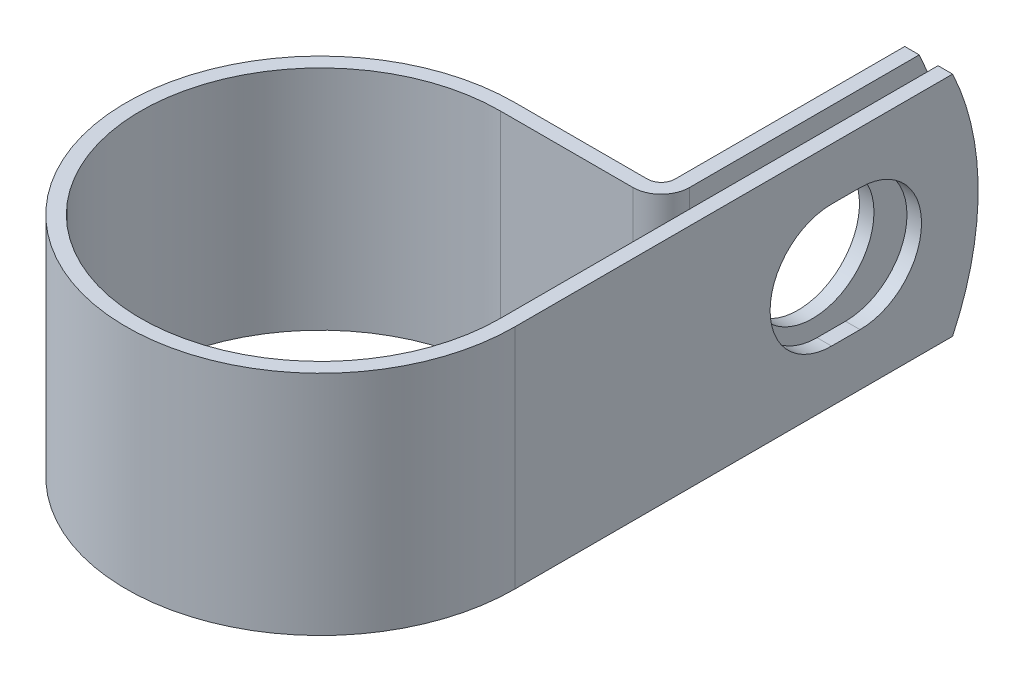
SolidWorks part; units mm, degrees
ref_plane "Front Plane" through (0, 0, 0) normal (0, 0, 1) x (1, 0, 0)
ref_plane "Top Plane" through (0, 0, 0) normal (0, 1, 0) x (1, 0, 0)
ref_plane "Right Plane" through (0, 0, 0) normal (1, 0, 0) x (0, 0, -1)
sketch "Sketch1" plane through (0, 0, 0) normal (0, 1, 0) x (1, 0, 0)
  line L0 (0, 15.0749) -> (11.1227, 15.0749)
  line L1 (15.0749, 0) -> (15.0749, 15.0749)
  line L2 (13.5001, 38.862) -> (13.5001, 17.4523)
  line L5 (15.0749, 15.0749) -> (15.0749, 38.862)
  arc A0 (0, 15.0749) -> (15.0749, 0) centre (0, 0) ccw
  arc A3 (11.1227, 15.0749) -> (13.5001, 17.4523) centre (11.1227, 17.4523) ccw
extrude "Extrude-Thin1" add sketch "Sketch1" along normal mid plane 19.05 thin
sketch "Sketch2" plane through (12.2809, 0, 0) normal (-1, 0, 0) x (0, 0, 1)
  line L0 (-38.862, 9.525) -> (-38.862, -9.525) construction
  line L7 (0, 9.525) -> (0, -9.525) construction
  circle A0 centre (-27.7622, 0) radius 5.1562
  point P2 (-38.862, 0)
extrude "Cut-Extrude1" cut sketch "Sketch2" against normal up to surface (1.2192 mm away)
sketch "Sketch3" plane through (16.2941, 0, 0) normal (1, 0, 0) x (0, 0, -1)
  line L0 (26.5684, 0) -> (28.956, 0) construction
  line L1 (26.5684, 5.1562) -> (28.956, 5.1562)
  line L2 (26.5684, -5.1562) -> (28.956, -5.1562)
  line L3 (38.862, 9.525) -> (38.862, -9.525) construction
  arc A0 (26.5684, 5.1562) -> (26.5684, -5.1562) centre (26.5684, 0) ccw
  arc A1 (28.956, -5.1562) -> (28.956, 5.1562) centre (28.956, 0) ccw
  point P3 (27.7622, 0)
  point P8 (38.862, 0)
  point P11 (21.4122, 0)
  point P12 (34.1122, 0)
extrude "Cut-Extrude2" cut sketch "Sketch3" against normal up to surface (1.2192 mm away)
sketch "Sketch4" plane through (12.2809, 0, 0) normal (-1, 0, 0) x (0, 0, 1)
  line L0 (-38.862, 9.525) -> (-38.862, -9.525)
  line L1 (-38.862, 9.525) -> (-36.7175, 9.525)
  line L2 (-38.862, 9.525) -> (-17.4523, 9.525) construction
  line L3 (-38.862, -9.525) -> (-36.7175, -9.525)
  line L4 (-38.862, -9.525) -> (-17.4523, -9.525) construction
  arc A0 (-36.7175, 9.525) -> (-36.7175, -9.525) centre (-16.637, 0) ccw
extrude "Cut-Extrude3" cut sketch "Sketch4" against normal through all contours A0 M4 M5 | A0 L0 M2
equation "\"D1@Sketch3\" = \"D2@Sketch2\""
equation "\"D7@Sketch1\" = \"D3@Sketch2\" + \"D1@Sketch3\""
equation "\"D1@Sketch4\" = ( \"D1@Extrude-Thin1\" + .125 ) * 2"
equation "\"D2@Sketch1\"=1.95*\"D5@Extrude-Thin1\""
equation "\"D2@Sketch3\" = \"D1@Sketch2\""
